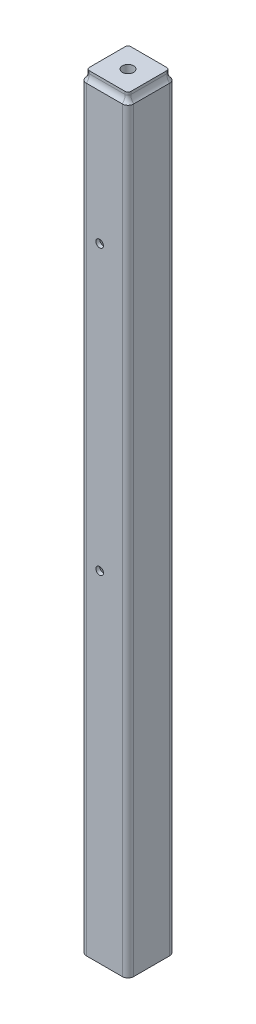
SolidWorks part; units mm, degrees
ref_plane "Front Plane" through (0, 0, 0) normal (0, 0, 1) x (1, 0, 0)
ref_plane "Top Plane" through (0, 0, 0) normal (0, 1, 0) x (1, 0, 0)
ref_plane "Right Plane" through (0, 0, 0) normal (1, 0, 0) x (0, 0, -1)
sketch "Sketch1" plane through (0, 0, 0) normal (0, 1, 0) x (1, 0, 0)
  line L1 (9.5, -12.5) -> (-9.5, -12.5)
  line L2 (12.5, -9.5) -> (12.5, 9.5)
  line L3 (9.5, 12.5) -> (-9.5, 12.5)
  line L4 (-12.5, -9.5) -> (-12.5, 9.5)
  line L5 (12.5, -12.5) -> (-12.5, 12.5) construction
  line L6 (12.5, 12.5) -> (-12.5, -12.5) construction
  line L7 (-9.5, -10.5) -> (9.5, -10.5)
  line L8 (-10.5, -9.5) -> (-10.5, 9.5)
  line L9 (-9.5, 10.5) -> (9.5, 10.5)
  line L10 (10.5, -9.5) -> (10.5, 9.5)
  line L11 (-10.5, -10.5) -> (10.5, 10.5) construction
  line L12 (-10.5, 10.5) -> (10.5, -10.5) construction
  arc A0 (-9.5, -12.5) -> (-12.5, -9.5) centre (-9.5, -9.5) cw
  arc A1 (9.5, -12.5) -> (12.5, -9.5) centre (9.5, -9.5) ccw
  arc A2 (12.5, 9.5) -> (9.5, 12.5) centre (9.5, 9.5) ccw
  arc A3 (-9.5, 12.5) -> (-12.5, 9.5) centre (-9.5, 9.5) ccw
  arc A4 (-9.5, -10.5) -> (-10.5, -9.5) centre (-9.5, -9.5) cw
  arc A5 (9.5, -10.5) -> (10.5, -9.5) centre (9.5, -9.5) ccw
  arc A6 (9.5, 10.5) -> (10.5, 9.5) centre (9.5, 9.5) cw
  arc A7 (-10.5, 9.5) -> (-9.5, 10.5) centre (-9.5, 9.5) cw
  point P0 (0, 0)
  point P6 (0, 0)
  dimension "D4" = 3
  dimension "D5" = 1
  dimension "D1" = 25
  dimension "D2" = 25
  dimension "D3" = 2
extrude "Boss-Extrude1" add sketch "Sketch1" along normal blind 400
sketch "Sketch2" plane through (0, 400, 0) normal (0, 1, 0) x (1, 0, 0)
  line L0 (-9.5, 11) -> (9.5, 11)
  line L1 (-9.5, 12.5) -> (9.5, 12.5) construction
  line L2 (-12.5, 9.5) -> (-12.5, -9.5) construction
  line L3 (-9.5, -12.5) -> (9.5, -12.5) construction
  line L4 (12.5, 9.5) -> (12.5, -9.5) construction
  line L5 (-12.5, 12.5) -> (12.5, -12.5) construction
  line L6 (-12.5, -12.5) -> (12.5, 12.5) construction
  line L7 (11, 9.5) -> (11, -9.5)
  line L8 (12.5, -9.5) -> (12.5, 9.5) construction
  line L9 (-9.5, -12.5) -> (9.5, -12.5) construction
  line L10 (-9.5, -11) -> (9.5, -11)
  line L11 (-11, 9.5) -> (-11, -9.5)
  arc A0 (-12.5, -9.5) -> (-9.5, -12.5) centre (-9.5, -9.5) ccw construction
  arc A1 (-9.5, 12.5) -> (-12.5, 9.5) centre (-9.5, 9.5) ccw construction
  arc A2 (9.5, 12.5) -> (12.5, 9.5) centre (9.5, 9.5) cw construction
  arc A3 (9.5, -12.5) -> (12.5, -9.5) centre (9.5, -9.5) ccw construction
  circle A4 centre (0, 0) radius 3
  arc A5 (9.5, 11) -> (11, 9.5) centre (9.5, 9.5) cw
  arc A6 (9.5, -11) -> (11, -9.5) centre (9.5, -9.5) ccw
  arc A7 (-11, -9.5) -> (-9.5, -11) centre (-9.5, -9.5) ccw
  arc A8 (-9.5, 11) -> (-11, 9.5) centre (-9.5, 9.5) ccw
  point P0 (0, 0)
  dimension "D1" = 3
  dimension "D2" = 6
  dimension "D3" = 1.5
extrude "Boss-Extrude2" add sketch "Sketch2" along normal blind 5
fillet "Fillet1" radius 5 8 edges at (-10.5607, 400, 10.5607) (-11, 400, 0) (-10.5607, 400, -10.5607) (0, 400, -11) (10.5607, 400, -10.5607) (11, 400, 0) (10.5607, 400, 10.5607) (0, 400, 11)
sketch "Sketch3" plane through (-12.5, 0, 0) normal (-1, 0, 0) x (0, 0, 1)
  line L0 (2.5, 330) -> (2.5, 180) construction
  line L1 (-9.5, 400) -> (9.5, 400) construction
  line L2 (-12.5, 400) -> (-12.5, 0) construction
  line L3 (2.5, 255) -> (-39.606, 255) construction
  circle A0 centre (2.5, 330) radius 2
  circle A1 centre (2.5, 180) radius 2
  dimension "D4" = 4
  dimension "D1" = 150
  dimension "D2" = 70
  dimension "D3" = 15
extrude "Cut-Extrude1" cut sketch "Sketch3" against normal blind 10
sketch "Sketch4" plane through (0, 0, 12.5) normal (0, 0, 1) x (1, 0, 0)
  line L0 (-2.5, 330) -> (-2.5, 180) construction
  line L1 (-2.5, 255) -> (55.466, 255) construction
  line L2 (12.5, 400) -> (12.5, 0) construction
  line L3 (-9.5, 405) -> (9.5, 405) construction
  circle A0 centre (-2.5, 330) radius 2
  circle A1 centre (-2.5, 180) radius 2
  dimension "D2" = 4
  dimension "D4" = 75
  dimension "D1" = 150
  dimension "D3" = 15
extrude "Cut-Extrude2" cut sketch "Sketch4" against normal blind 10
